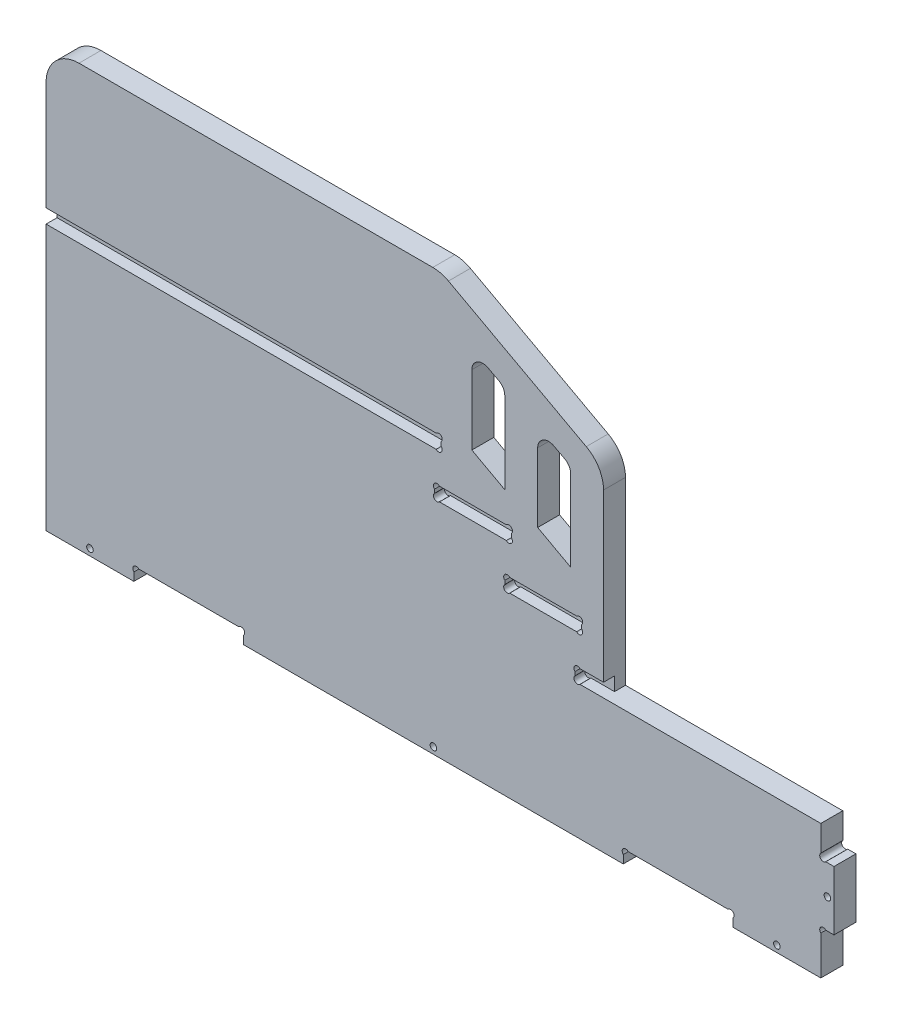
SolidWorks part; units mm, degrees
ref_plane "Face" through (0, 0, 0) normal (0, 0, 1) x (1, 0, 0)
ref_plane "Dessus" through (0, 0, 0) normal (0, 1, 0) x (1, 0, 0)
ref_plane "Droite" through (0, 0, 0) normal (1, 0, 0) x (0, 0, -1)
sketch "Esquisse1" plane through (0, 0, 0) normal (0, 0, 1) x (1, 0, 0)
  line L0 (294.7619, -27.7467) -> (210.7619, -27.7467)
  line L1 (-58.2381, 103.2533) -> (210.7619, 103.2533)
  line L2 (-58.2381, 32.2533) -> (-58.2381, -88.7467)
  line L3 (-58.2381, -88.7467) -> (294.7619, -88.7467)
  line L4 (294.7619, -27.7467) -> (294.7619, -88.7467)
  line L5 (210.7619, -27.7467) -> (210.7619, -21.7467)
  line L6 (210.7619, 103.2533) -> (210.7619, -21.7467)
  line L8 (-58.2381, 103.2533) -> (-58.2381, 32.2533)
  dimension "D7" = 71
  dimension "D1" = 353
  dimension "D2" = 121
  dimension "D4" = 61
  dimension "D5" = 84
  dimension "D6" = 6
extrude "Base-Extrusion" add sketch "Esquisse1" along normal blind 10
sketch "Esquisse10" plane through (0, 0, 10) normal (0, 0, 1) x (1, 0, 0)
  line L0 (294.7619, -88.7467) -> (294.7619, -27.7467) construction
  line L1 (185.7619, -7.7467) -> (150.7619, -7.7467)
  line L2 (185.7619, -7.7467) -> (185.7619, -1.5467)
  line L3 (185.7619, -1.5467) -> (150.7619, -1.5467)
  line L4 (150.7619, -7.7467) -> (150.7619, -1.5467)
  line L5 (153.7619, 12.2533) -> (118.7619, 12.2533)
  line L6 (153.7619, 12.2533) -> (153.7619, 18.4533)
  line L7 (153.7619, 18.4533) -> (118.7619, 18.4533)
  line L8 (118.7619, 12.2533) -> (118.7619, 18.4533)
  line L9 (294.7619, -27.7467) -> (210.7619, -27.7467) construction
  line L11 (210.7619, -27.7467) -> (182.7619, -27.7467)
  line L12 (210.7619, -27.7467) -> (210.7619, -21.5467)
  line L13 (210.7619, -21.5467) -> (182.7619, -21.5467)
  line L14 (182.7619, -27.7467) -> (182.7619, -21.5467)
  dimension "D1" = 35
  dimension "D2" = 35
  dimension "D3" = 6.2
  dimension "D4" = 6.2
  dimension "D5" = 109
  dimension "D6" = 20
  dimension "D7" = 20
  dimension "D8" = 3
  dimension "D9" = 6.2
  dimension "D10" = 3
sketch "Esquisse9" plane through (0, 0, 10) normal (0, 0, 1) x (1, 0, 0)
  line L0 (-58.2381, 103.2533) -> (-58.2381, -88.7467) construction
  line L1 (-58.2381, 38.6533) -> (121.7619, 38.6533)
  line L2 (-58.2381, 38.6533) -> (-58.2381, 32.2533)
  line L3 (-58.2381, 32.2533) -> (121.7619, 32.2533)
  line L4 (121.7619, 38.6533) -> (121.7619, 32.2533)
  line L5 (-58.2381, -88.7467) -> (294.7619, -88.7467) construction
  line L6 (210.7619, -27.7467) -> (210.7619, 103.2533) construction
  dimension "D1" = 6.4
  dimension "D2" = 121
  dimension "D3" = 89
extrude "Enlèv. mat.-Extru.6" cut sketch "Esquisse10" against normal blind 5
extrude "Enlèv. mat.-Extru.5" cut sketch "Esquisse9" against normal blind 5
sketch "Esquisse5" plane through (0, 0, 10) normal (0, 0, 1) x (1, 0, 0)
  line L0 (-58.2381, -88.7467) -> (294.7619, -88.7467) construction
  line L1 (254.7619, -88.7467) -> (204.7619, -88.7467)
  line L2 (254.7619, -88.7467) -> (254.7619, -82.7467)
  line L3 (254.7619, -82.7467) -> (204.7619, -82.7467)
  line L4 (204.7619, -88.7467) -> (204.7619, -82.7467)
  line L5 (294.7619, -88.7467) -> (294.7619, -27.7467) construction
  line L6 (-18.2381, -88.7467) -> (31.7619, -88.7467)
  line L7 (-18.2381, -88.7467) -> (-18.2381, -82.7467)
  line L8 (-18.2381, -82.7467) -> (31.7619, -82.7467)
  line L9 (31.7619, -88.7467) -> (31.7619, -82.7467)
  line L10 (-58.2381, 32.2533) -> (-58.2381, -88.7467) construction
  dimension "D1" = 40
  dimension "D2" = 50
  dimension "D3" = 6
  dimension "D4" = 6
  dimension "D5" = 50
  dimension "D6" = 40
extrude "Enlèv. mat.-Extru.3" cut sketch "Esquisse5" against normal up to vertex
sketch "Esquisse11" plane through (0, 0, 10) normal (0, 0, 1) x (1, 0, 0)
  line L0 (210.7619, -27.7467) -> (195.7619, -27.7467)
  line L1 (294.7619, -27.7467) -> (182.7619, -27.7467) construction
  line L2 (195.7619, -27.7467) -> (195.7619, 63.2533)
  line L3 (195.7619, 63.2533) -> (121.7619, 103.2533)
  line L4 (210.7619, 103.2533) -> (-58.2381, 103.2533) construction
  line L5 (121.7619, 103.2533) -> (210.7619, 103.2533)
  line L6 (210.7619, 103.2533) -> (210.7619, -27.7467)
  dimension "D1" = 15
  dimension "D2" = 91
  dimension "D3" = 89
extrude "Enlèv. mat.-Extru.7" cut sketch "Esquisse11" against normal up to vertex
sketch "Esquisse8" plane through (294.7619, 0, 0) normal (1, 0, 0) x (0, 0, -1)
  line L0 (-10, -88.7467) -> (-10, -27.7467) construction
  line L1 (-10, -41.7467) -> (0, -41.7467)
  line L2 (-10, -41.7467) -> (-10, -68.7467)
  line L3 (-10, -68.7467) -> (0, -68.7467)
  line L4 (0, -41.7467) -> (0, -68.7467)
  line L5 (0, -88.7467) -> (0, -27.7467) construction
  line L7 (-10, -88.7467) -> (0, -88.7467) construction
  line L8 (-10, -27.7467) -> (0, -27.7467) construction
  dimension "D1" = 14
  dimension "D2" = 20
extrude "Extrusion2" add sketch "Esquisse8" along normal blind 6
sketch "Esquisse3"
  line L2 (254.7619, -88.7467) -> (254.7619, -82.7467) construction
  line L3 (204.7619, -82.7467) -> (204.7619, -88.7467) construction
  line L4 (254.7619, -82.7467) -> (204.7619, -82.7467) construction
  line L5 (31.7619, -82.7467) -> (-18.2381, -82.7467) construction
  line L6 (-18.2381, -82.7467) -> (-18.2381, -88.7467) construction
  line L7 (31.7619, -88.7467) -> (31.7619, -82.7467) construction
  line L10 (294.7619, -41.7467) -> (294.7619, -27.7467) construction
  line L11 (300.7619, -41.7467) -> (294.7619, -41.7467) construction
  line L12 (300.7619, -68.7467) -> (294.7619, -68.7467) construction
  line L13 (294.7619, -88.7467) -> (294.7619, -68.7467) construction
  circle A1 centre (253.6619, -83.8467) radius 1.6
  circle A2 centre (205.8619, -83.8467) radius 1.6
  circle A3 centre (30.6619, -83.8467) radius 1.6
  circle A4 centre (-17.1381, -83.8467) radius 1.6
  circle A6 centre (295.8619, -40.6467) radius 1.6
  circle A7 centre (295.8619, -69.8467) radius 1.6
  point P24 (31.7619, -85.7467)
  dimension "D3" = 1.1
  dimension "D7" = 1.1
  dimension "D13" = 1.1
  dimension "D15" = 1.1
  dimension "D4" = 1.1
  dimension "D5" = 1.1
  dimension "D6" = 1.1
  dimension "D8" = 1.1
  dimension "D9" = 1.1
  dimension "D10" = 1.1
  dimension "D14" = 1.1
  dimension "D16" = 1.1
extrude "Enlèv. mat.-Extru.4" cut sketch "Esquisse6" against normal up to vertex
sketch "Esquisse6" plane through (0, 0, 10) normal (0, 0, 1) x (1, 0, 0)
  line L0 (294.7619, -88.7467) -> (294.7619, -71.0086) construction
  line L1 (254.7619, -88.7467) -> (294.7619, -88.7467) construction
  line L2 (31.7619, -88.7467) -> (204.7619, -88.7467) construction
  line L3 (-58.2381, 32.2533) -> (-58.2381, -88.7467) construction
  line L4 (-58.2381, -88.7467) -> (-18.2381, -88.7467) construction
  line L5 (31.7619, -88.7467) -> (31.7619, -85.0086) construction
  line L7 (300.7619, -41.7467) -> (297.0238, -41.7467) construction
  line L9 (300.7619, -41.7467) -> (300.7619, -68.7467) construction
  circle A0 centre (-38.2381, -85.7467) radius 1.5
  circle A1 centre (118.2619, -85.7467) radius 1.5
  circle A2 centre (274.7619, -85.7467) radius 1.5
  circle A3 centre (297.7619, -55.2467) radius 1.5
  dimension "D1" = 20
  dimension "D7" = 13.5
  dimension "D2" = 3
  dimension "D3" = 3
  dimension "D4" = 20
  dimension "D5" = 3
  dimension "D6" = 86.5
  dimension "D8" = 3
extrude "Enlèv. mat.-Extru.2" cut sketch "Esquisse3" against normal up to vertex
sketch "Esquisse12" plane through (0, 0, 10) normal (0, 0, 1) x (1, 0, 0)
  line L0 (185.7619, -7.7467) -> (185.7619, -1.5467) construction
  line L1 (153.7619, 12.2533) -> (153.7619, 18.4533) construction
  line L2 (153.7619, 18.4533) -> (118.7619, 18.4533) construction
  line L3 (185.7619, -1.5467) -> (150.7619, -1.5467) construction
  circle A0 centre (168.2619, -4.6467) radius 1.5
  circle A1 centre (136.2619, 15.3533) radius 1.5
  point P4 (185.7619, -4.6467)
  point P7 (153.7619, 15.3533)
  dimension "D1" = 17.5
  dimension "D2" = 17.5
  dimension "D3" = 3.1
  dimension "D4" = 3.1
extrude "Enlèv. mat.-Extru.8" cut sketch "Esquisse12" against normal up to vertex (10 mm away)
sketch "Esquisse13" plane through (0, 0, 10) normal (0, 0, 1) x (1, 0, 0)
  line L0 (121.7619, 32.2533) -> (121.7619, 38.6533) construction
  line L1 (121.7619, 38.6533) -> (-58.2381, 38.6533) construction
  line L2 (-58.2381, 32.2533) -> (121.7619, 32.2533) construction
  line L3 (118.7619, 18.4533) -> (118.7619, 12.2533) construction
  line L4 (153.7619, 18.4533) -> (118.7619, 18.4533) construction
  line L5 (118.7619, 12.2533) -> (153.7619, 12.2533) construction
  line L6 (153.7619, 12.2533) -> (153.7619, 18.4533) construction
  line L7 (185.7619, -1.5467) -> (150.7619, -1.5467) construction
  line L8 (150.7619, -7.7467) -> (185.7619, -7.7467) construction
  line L9 (150.7619, -1.5467) -> (150.7619, -7.7467) construction
  line L10 (185.7619, -7.7467) -> (185.7619, -1.5467) construction
  line L11 (182.7619, -21.5467) -> (182.7619, -27.7467) construction
  line L12 (195.7619, -21.5467) -> (182.7619, -21.5467) construction
  line L13 (294.7619, -27.7467) -> (182.7619, -27.7467) construction
  circle A0 centre (183.8619, -22.6467) radius 1.6
  circle A1 centre (183.8619, -26.6467) radius 1.6
  circle A2 centre (184.6619, -2.6467) radius 1.6
  circle A3 centre (184.6619, -6.6467) radius 1.6
  circle A4 centre (151.8619, -2.6467) radius 1.6
  circle A5 centre (151.8619, -6.6467) radius 1.6
  circle A6 centre (152.6619, 17.3533) radius 1.6
  circle A7 centre (152.6619, 13.3533) radius 1.6
  circle A8 centre (119.8619, 17.3533) radius 1.6
  circle A9 centre (119.8619, 13.3533) radius 1.6
  circle A10 centre (120.6619, 37.5533) radius 1.6
  circle A11 centre (120.6619, 33.3533) radius 1.6
  point P42 (150.7619, -4.6467)
  dimension "D1" = 1.1
  dimension "D2" = 1.1
  dimension "D3" = 1.1
  dimension "D4" = 1.1
  dimension "D5" = 1.1
  dimension "D6" = 1.1
  dimension "D7" = 1.1
  dimension "D8" = 1.1
  dimension "D9" = 1.1
  dimension "D10" = 1.1
  dimension "D11" = 1.1
  dimension "D12" = 1.1
  dimension "D13" = 1.1
  dimension "D14" = 1.1
  dimension "D15" = 1.1
  dimension "D16" = 1.1
  dimension "D17" = 1.1
  dimension "D18" = 1.1
  dimension "D19" = 1.1
  dimension "D20" = 1.1
  dimension "D21" = 1.1
  dimension "D22" = 1.1
  dimension "D23" = 1.1
  dimension "D24" = 1.1
extrude "Enlèv. mat.-Extru.9" cut sketch "Esquisse13" against normal blind 5
fillet "Congé1" radius 15 3 edges at (195.7619, 63.2533, 5) (121.7619, 103.2533, 5) (-58.2381, 103.2533, 5)
sketch "Esquisse14" plane through (0, 0, 10) normal (0, 0, 1) x (1, 0, 0)
  line L0 (119.5, 88.6533) -> (195.7619, 48.4533) construction
  line L1 (180.7619, 56.3603) -> (165.7619, 64.2673)
  line L2 (165.7619, 69.0148) -> (165.7619, 13.9332) construction
  line L3 (165.7619, 64.2673) -> (165.7619, 24.5258)
  line L4 (180.7619, 69.0148) -> (180.7619, 13.9332) construction
  line L5 (165.7619, 24.5258) -> (180.7619, 16.3603)
  line L6 (150.7619, 26.3795) -> (150.7619, 84.6389) construction
  line L7 (180.7619, 16.3603) -> (180.7619, 56.3603)
  line L8 (135.7619, 26.3795) -> (135.7619, 84.6389) construction
  line L9 (195.7619, 8.4533) -> (119.5, 48.6533) construction
  line L10 (195.7619, 54.3103) -> (195.7619, -21.5467) construction
  line L11 (135.7619, 80.0812) -> (150.7619, 72.1742)
  line L12 (119.5, 38.6533) -> (-58.2381, 38.6533) construction
  line L13 (183.5, -1.5467) -> (153.0238, -1.5467) construction
  line L14 (150.7619, 72.1742) -> (150.7619, 31.9406)
  line L15 (150.7619, 31.9406) -> (135.7619, 40.0812)
  line L16 (135.7619, 40.0812) -> (135.7619, 80.0812)
  dimension "D1" = 10
  dimension "D2" = 10
  dimension "D3" = 50
  dimension "D4" = 50
  dimension "D5" = 15
  dimension "D6" = 15
  dimension "D7" = 15
  dimension "D8" = 15
extrude "Enlèv. mat.-Extru.10" cut sketch "Esquisse14" against normal up to vertex (10 mm away)
fillet "Congé2" radius 5 4 edges at (180.7619, 56.3603, 5) (150.7619, 72.1742, 5) (165.7619, 64.2673, 5) (135.7619, 80.0812, 5)
